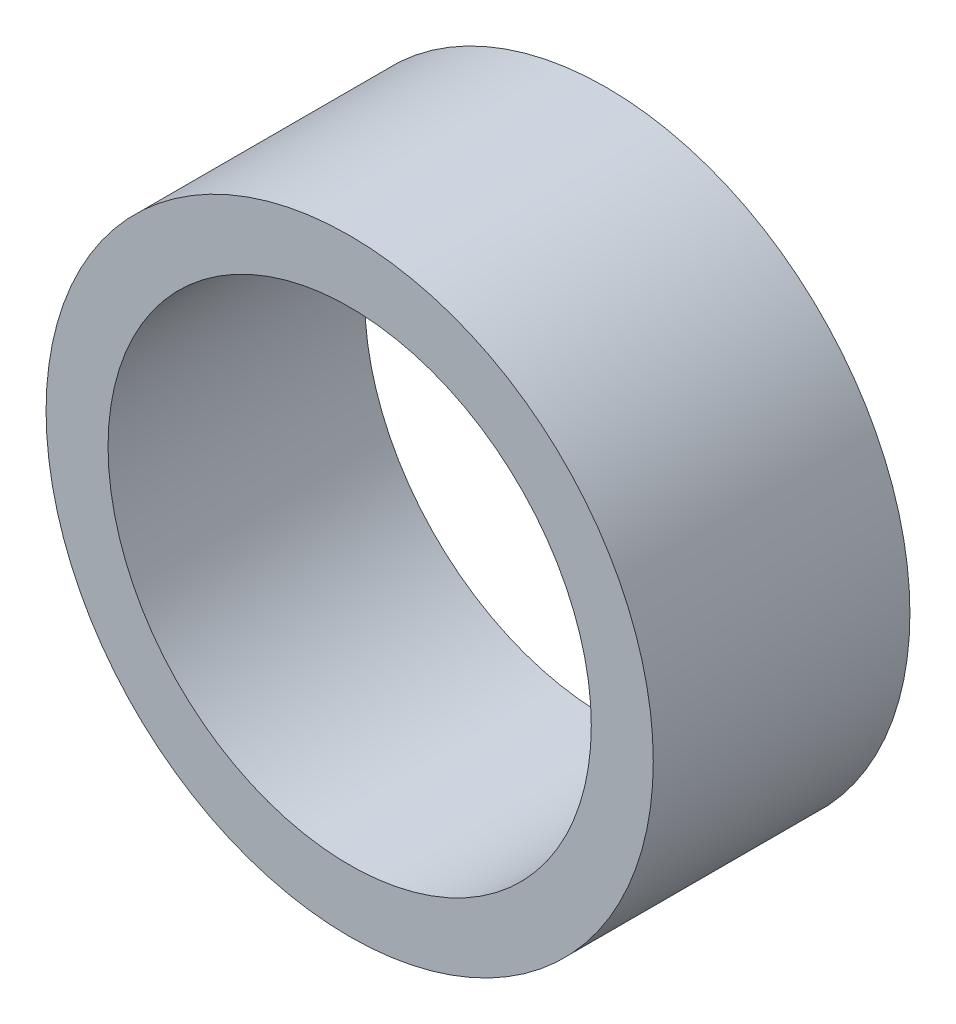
SolidWorks part; units mm, degrees
ref_plane "Front" through (0, 0, 0) normal (0, 0, 1) x (1, 0, 0)
ref_plane "Top" through (0, 0, 0) normal (0, 1, 0) x (1, 0, 0)
ref_plane "Right" through (0, 0, 0) normal (1, 0, 0) x (0, 0, -1)
sketch "Sketch1" plane through (0, 0, 0) normal (0, 0, 1) x (1, 0, 0)
  line L0 (0, 0) -> (1.1684, 0) construction
  circle A0 centre (1.1684, 0) radius 6.1595
  dimension "D2" = 1.1684
  dimension "D1" = 12.319
extrude "Extrude1" add sketch "Sketch1" along normal blind 5.207
sketch "Sketch5" plane through (0, 0, 0) normal (0, 0, -1) x (-1, 0, 0)
  circle A0 centre (-1.1684, 0) radius 4.9022
  circle A3 centre (-1.1684, 0) radius 6.1595 construction
  dimension "D1" = 9.8044
extrude "Cut-Extrude3" cut sketch "Sketch5" against normal through all
